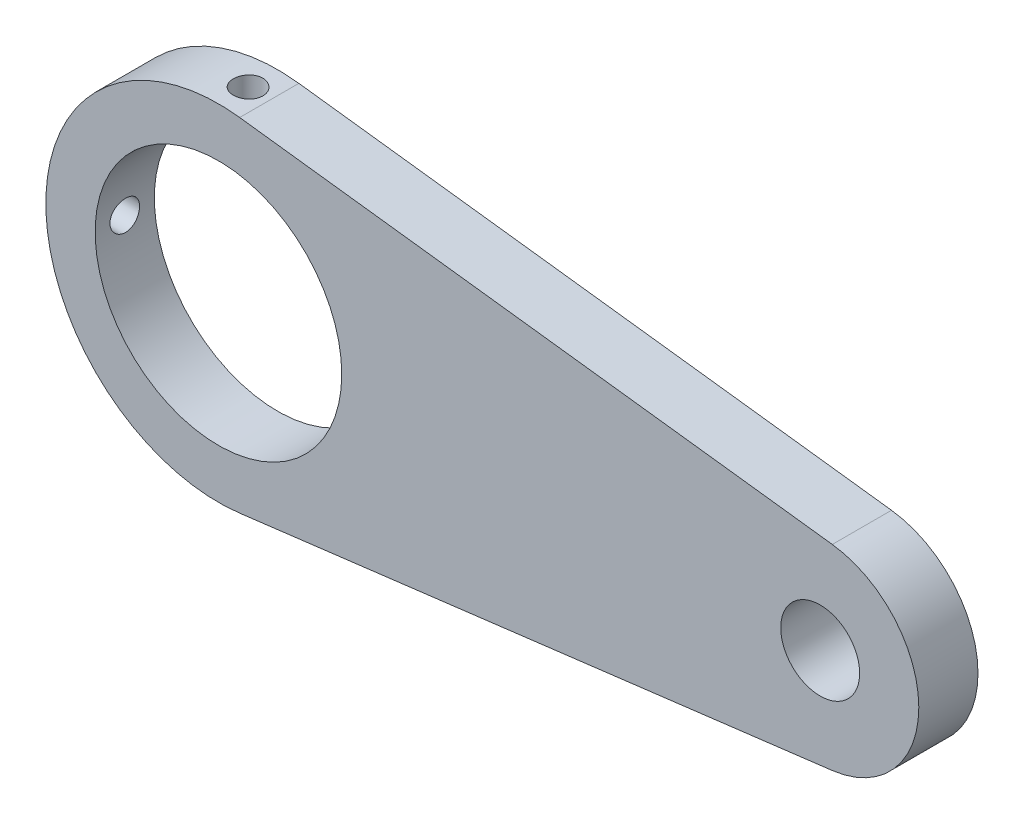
SolidWorks part; units mm, degrees
ref_plane "前视基准面" through (0, 0, 0) normal (0, 0, 1) x (1, 0, 0)
ref_plane "上视基准面" through (0, 0, 0) normal (0, 1, 0) x (1, 0, 0)
ref_plane "右视基准面" through (0, 0, 0) normal (1, 0, 0) x (0, 0, -1)
sketch "草图1" plane through (0, 0, 0) normal (0, 0, 1) x (1, 0, 0)
  line L0 (0, 0) -> (122, 0) construction
  line L1 (4.3033, 34.7344) -> (124.459, 19.8483)
  line L2 (4.3033, -34.7344) -> (124.459, -19.8483)
  arc A0 (4.3033, 34.7344) -> (4.3033, -34.7344) centre (0, 0) ccw
  circle A1 centre (0, 0) radius 25
  arc A2 (124.459, -19.8483) -> (124.459, 19.8483) centre (122, 0) ccw
  circle A3 centre (122, 0) radius 8
extrude "凸台-拉伸1" add sketch "草图1" along normal blind 12
ref_plane "基准面1" through (0, 35, 0) normal (0, 1, 0) x (1, 0, 0)
sketch "草图2" plane through (0, 35, 0) normal (0, 1, 0) x (1, 0, 0)
  line L0 (0, 0) -> (0, -12) construction
  circle A0 centre (0, -6) radius 3
extrude "切除-拉伸1" cut sketch "草图2" against normal blind 12
ref_plane "基准面2" through (-35, 0, 0) normal (1, 0, 0) x (0, 0, -1)
sketch "草图3" plane through (-35, 0, 0) normal (1, 0, 0) x (0, 0, -1)
  line L0 (0, 0) -> (-12, 0) construction
  circle A0 centre (-6, 0) radius 3
extrude "切除-拉伸2" cut sketch "草图3" along normal blind 17
